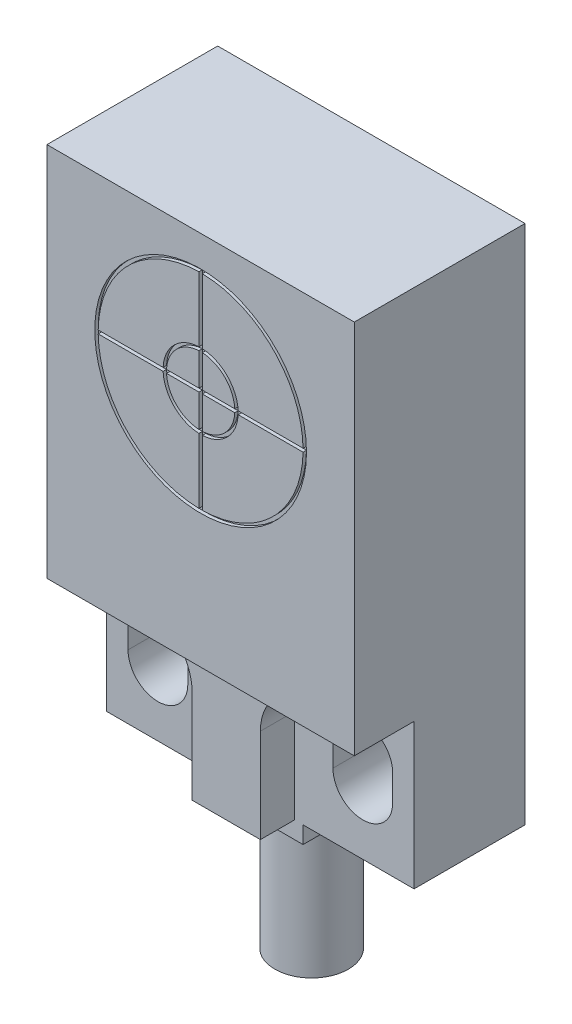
SolidWorks part; units mm, degrees
ref_plane "前视基准面" through (0, 0, 0) normal (0, 0, 1) x (1, 0, 0)
ref_plane "上视基准面" through (0, 0, 0) normal (0, 1, 0) x (1, 0, 0)
ref_plane "右视基准面" through (0, 0, 0) normal (1, 0, 0) x (0, 0, -1)
sketch "草图1" plane through (0, 0, 0) normal (0, 0, 1) x (1, 0, 0)
  line L0 (0, 0) -> (0, 30.5)
  line L1 (0, 30.5) -> (18, 30.5)
  line L2 (18, 30.5) -> (18, 0)
  line L3 (18, 0) -> (0, 0)
extrude "凸台-拉伸2" add sketch "草图1" along normal blind 10 contours L1 L2 L3 L0
sketch "草图3" plane through (0, 0, 10) normal (0, 0, 1) x (1, 0, 0)
  line L0 (18, 0) -> (18, 8.5)
  line L1 (18, 30.5) -> (18, 0) construction
  line L3 (0, 0) -> (0, 30.5) construction
  line L4 (0, 8.5) -> (0, 0)
  line L6 (18, 0) -> (0, 0) construction
  line L7 (11, 0) -> (11, 5.5)
  line L8 (7, 0) -> (7, 5.5)
  line L9 (7, 0) -> (0, 0)
  line L10 (0, 8.5) -> (4, 8.5)
  line L11 (14, 8.5) -> (18, 8.5)
  line L12 (11, 0) -> (18, 0)
  arc A0 (11, 5.5) -> (14, 8.5) centre (14, 5.5) cw
  arc A1 (7, 5.5) -> (4, 8.5) centre (4, 5.5) ccw
  dimension "D1" = 3
extrude "切除-拉伸1" cut sketch "草图3" against normal blind 3.5
sketch "草图4" plane through (0, 0, 10) normal (0, 0, 1) x (1, 0, 0)
  line L0 (7, 0) -> (11, 0)
  line L1 (11, 0) -> (11, 5.5)
  line L2 (7, 0) -> (7, 5.5)
  line L3 (4, 8.5) -> (14, 8.5)
  arc A0 (14, 8.5) -> (11, 5.5) centre (14, 5.5) ccw construction
  arc A1 (14, 8.5) -> (11, 5.5) centre (14, 5.5) ccw construction
  arc A2 (14, 8.5) -> (11, 5.5) centre (14, 5.5) ccw
  arc A3 (7, 5.5) -> (4, 8.5) centre (4, 5.5) ccw
extrude "切除-拉伸2" cut sketch "草图4" against normal blind 1.5
sketch "草图6" plane through (0, 0, 6.5) normal (0, 0, 1) x (1, 0, 0)
  line L0 (9, 0) -> (15, 0)
  line L1 (7, 0) -> (11, 0) construction
  line L2 (11, 0) -> (18, 0) construction
  line L3 (16.75, 5.25) -> (16.75, 3.75)
  line L7 (13.25, 3.75) -> (13.25, 5.25)
  arc A0 (16.75, 5.25) -> (13.25, 5.25) centre (15, 5.25) ccw
  arc A1 (13.25, 3.75) -> (16.75, 3.75) centre (15, 3.75) ccw
  point P6 (0, 0)
  point P8 (0, 0)
extrude "切除-拉伸3" cut sketch "草图6" against normal blind 6.5 contours A0 L7 A1 L3
sketch "草图7" plane through (0, 0, 6.5) normal (0, 0, 1) x (1, 0, 0)
  line L0 (1.25, 5.25) -> (1.25, 3.75)
  line L2 (4.75, 5.25) -> (4.75, 3.75)
  arc A0 (1.25, 3.75) -> (4.75, 3.75) centre (3, 3.75) ccw
  arc A1 (4.75, 5.25) -> (1.25, 5.25) centre (3, 5.25) ccw
extrude "切除-拉伸4" cut sketch "草图7" against normal blind 6.5
sketch "草图9" plane through (0, 0, 0) normal (0, -1, 0) x (1, 0, 0)
  line L2 (9, 6.5) -> (11.5, 6.5)
  line L3 (11, 6.5) -> (18, 6.5) construction
  line L4 (9, 6.5) -> (6.5, 6.5)
  line L5 (0, 6.5) -> (7, 6.5) construction
  line L6 (11.5, 6.5) -> (11.5, 0.5)
  line L7 (11.5, 0.5) -> (6.5, 0.5)
  line L8 (6.5, 0.5) -> (6.5, 6.5)
  point P11 (9, 7.5)
extrude "凸台-拉伸3" add sketch "草图9" along normal blind 1
sketch "草图10" plane through (0, -1, 0) normal (0, -1, 0) x (1, 0, 0)
  circle A0 centre (9, 3.5) radius 2.15
extrude "凸台-拉伸5" add sketch "草图10" along normal blind 8 contours A0
sketch "草图11" plane through (0, 0, 10) normal (0, 0, 1) x (1, 0, 0)
  line L0 (18, 0) -> (18, 22.5)
  line L1 (18, 30.5) -> (18, 8.5) construction
  circle A0 centre (9, 22.5) radius 6
  circle A1 centre (9, 22.5) radius 6.2
  point P8 (0, 0)
extrude "切除-拉伸5" cut sketch "草图11" against normal blind 0.2 contours A1 | A0
sketch "草图12" plane through (0, 0, 10) normal (0, 0, 1) x (1, 0, 0)
  circle A0 centre (9, 22.5) radius 2
  circle A1 centre (9, 22.5) radius 2.2
extrude "切除-拉伸6" cut sketch "草图12" against normal blind 0.2
sketch "草图13" plane through (0, 0, 10) normal (0, 0, 1) x (1, 0, 0)
  line L0 (15, 22.5) -> (3, 22.5)
  line L2 (9, 28.5) -> (9, 16.5)
  circle A0 centre (9, 22.5) radius 6 construction
  circle A1 centre (9, 22.5) radius 6 construction
extrude "切除-拉伸-薄壁1" cut sketch "草图13" against normal blind 0.2 thin
sketch "草图14" plane through (0, 0, 0) normal (-1, 0, 0) x (0, 0, 1)
  line L1 (0, 0) -> (7.5, 0)
  line L2 (6.5, 0) -> (8.5, 0) construction
  circle A0 centre (7.5, 12.5) radius 1.3
extrude "切除-拉伸7" cut sketch "草图14" against normal blind 0.2 contours A0
